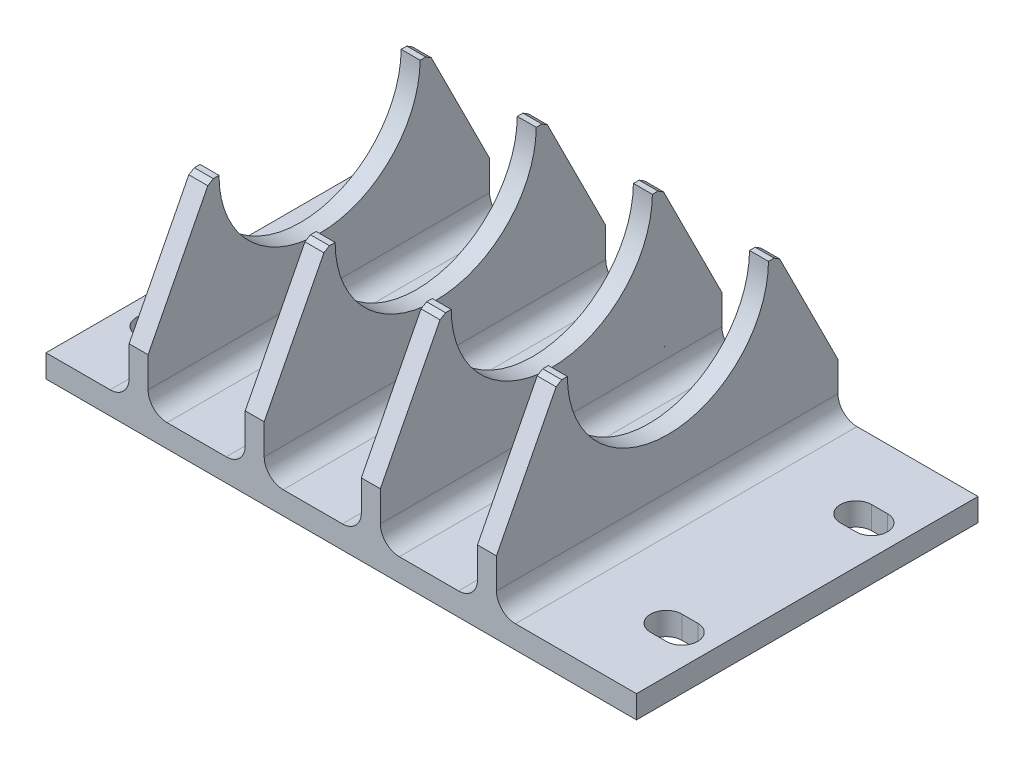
SolidWorks part; units mm, degrees
ref_plane "Front Plane" through (0, 0, 0) normal (0, 0, 1) x (1, 0, 0)
ref_plane "Top Plane" through (0, 0, 0) normal (0, 1, 0) x (1, 0, 0)
ref_plane "Right Plane" through (0, 0, 0) normal (1, 0, 0) x (0, 0, -1)
sketch "Sketch1" plane through (0, 0, 0) normal (0, 1, 0) x (1, 0, 0)
  line L0 (-77.8, 45) -> (77.8, 45)
  line L1 (-77.8, 45) -> (-77.8, -45)
  line L2 (-77.8, -45) -> (77.8, -45)
  line L3 (77.8, 45) -> (77.8, -45)
  circle A0 centre (-69.8, 25) radius 4.15
  circle A1 centre (-69.8, -25) radius 4.15
  circle A2 centre (69.8, 25) radius 4.15
  circle A3 centre (69.8, -25) radius 4.15
  dimension "D1" = 8.3
extrude "Boss-Extrude1" add sketch "Sketch1" along normal blind 6
sketch "Sketch4" plane through (0, 0, 45) normal (0, 0, 1) x (1, 0, 0)
  line L0 (-77.8, 6) -> (77.8, 6) construction
  line L1 (40.9, 6) -> (35.9, 6)
  line L2 (40.9, 6) -> (40.9, 56)
  line L3 (40.9, 56) -> (35.9, 56)
  line L4 (35.9, 6) -> (35.9, 56)
  line L6 (77.8, 6) -> (77.8, 0) construction
  dimension "D1" = 36.9
  dimension "D2" = 5
  dimension "D3" = 50
extrude "Boss-Extrude2" add sketch "Sketch4" against normal blind 90
pattern_linear "LPattern1" count 4 spacing 30.6 along (-1, 0, 0) of "Boss-Extrude2"
sketch "Sketch5" plane through (-55.9, 0, 0) normal (-1, 0, 0) x (0, 0, 1)
  line L1 (26.3067, 50.5874) -> (27.8067, 50.5874)
  line L2 (29.2629, 49.6975) -> (45, 19)
  line L3 (45, 56) -> (45, 6) construction
  line L5 (27.8067, 50.5874) -> (29.2629, 49.6975)
  line L8 (-28.1923, 50.3446) -> (-29.6407, 49.4421)
  line L10 (-29.6407, 49.4421) -> (-45.111, 18.6093)
  line L11 (-26.6923, 50.3576) -> (-28.1923, 50.3446)
  line L12 (45, 19) -> (60.8204, 19)
  line L13 (60.8204, 19) -> (60.8204, 68.7433)
  line L14 (60.8204, 68.7433) -> (-54.7485, 68.7433)
  line L15 (-54.7485, 68.7433) -> (-54.7485, 18.6093)
  line L16 (-54.7485, 18.6093) -> (-45.111, 18.6093)
  arc A0 (-26.6923, 50.3576) -> (26.3067, 50.5874) centre (-0.1933, 50.5874) ccw
  point P5 (28.8067, 50.5874)
  point P21 (-29.1922, 50.3359)
  dimension "D1" = 53
  dimension "D3" = 2.5
extrude "Cut-Extrude3" cut sketch "Sketch5" against normal blind 160
fillet "Fillet1" radius 5 8 edges at (10.3, 6, 0) (-20.3, 6, 0) (-50.9, 6, 0) (5.3, 6, 0) (-25.3, 6, 0) (-55.9, 6, 0)
sketch "Sketch6" plane through (0, 6, 0) normal (0, 1, 0) x (1, 0, 0)
  line L0 (-69.8, 25) -> (-65.65, 25) construction
  line L1 (-69.8, 29.15) -> (-65.65, 29.15)
  line L2 (-69.8, 20.85) -> (-65.65, 20.85)
  line L3 (-69.8, -25) -> (-65.65, -25) construction
  line L4 (-69.8, -20.85) -> (-65.65, -20.85)
  line L5 (-69.8, -29.15) -> (-65.65, -29.15)
  line L6 (69.8, 25) -> (65.65, 25) construction
  line L7 (69.8, 20.85) -> (65.65, 20.85)
  line L8 (69.8, 29.15) -> (65.65, 29.15)
  line L9 (69.8, -25) -> (65.65, -25) construction
  line L10 (69.8, -29.15) -> (65.65, -29.15)
  line L11 (69.8, -20.85) -> (65.65, -20.85)
  circle A0 centre (-69.8, 25) radius 4.15 construction
  arc A1 (-69.8, 29.15) -> (-69.8, 20.85) centre (-69.8, 25) ccw
  arc A2 (-65.65, 20.85) -> (-65.65, 29.15) centre (-65.65, 25) ccw
  circle A3 centre (-69.8, -25) radius 4.15 construction
  arc A4 (-69.8, -20.85) -> (-69.8, -29.15) centre (-69.8, -25) ccw
  arc A5 (-65.65, -29.15) -> (-65.65, -20.85) centre (-65.65, -25) ccw
  circle A6 centre (69.8, 25) radius 4.15 construction
  arc A7 (69.8, 20.85) -> (69.8, 29.15) centre (69.8, 25) ccw
  arc A8 (65.65, 29.15) -> (65.65, 20.85) centre (65.65, 25) ccw
  circle A9 centre (69.8, -25) radius 4.15 construction
  arc A10 (69.8, -29.15) -> (69.8, -20.85) centre (69.8, -25) ccw
  arc A11 (65.65, -20.85) -> (65.65, -29.15) centre (65.65, -25) ccw
  point P5 (-67.725, 25)
  point P15 (-67.725, -25)
  point P25 (67.725, 25)
  point P35 (67.725, -25)
  dimension "D1" = 8.3
  dimension "D2" = 8.3
  dimension "D3" = 8.3
  dimension "D4" = 8.3
extrude "Cut-Extrude4" cut sketch "Sketch6" against normal blind 10
sketch "Sketch7" plane through (0, 0, 0) normal (0, -1, 0) x (-1, 0, 0)
  line L0 (0, 0) -> (60, 0) construction
  line L1 (0, 0) -> (-45, 0) construction
  line L2 (0, -29.0247) -> (0, 28.2974) construction
  arc A0 (65.2521, -8.5098) -> (65.2521, 8.5098) centre (60, 0) ccw
  arc A1 (-65.2521, 8.5098) -> (-65.2521, -8.5098) centre (-60, 0) ccw
  arc A2 (65.2521, -8.5098) -> (-65.2521, -8.5098) centre (0, 97.2162) cw
  arc A3 (65.2521, 8.5098) -> (-65.2521, 8.5098) centre (0, -97.2162) ccw
  arc A4 (66.3025, -10.2117) -> (-66.3025, -10.2117) centre (0, 97.2162) cw
  arc A5 (-66.3025, 10.2117) -> (-66.3025, -10.2117) centre (-60, 0) ccw
  arc A6 (66.3025, 10.2117) -> (-66.3025, 10.2117) centre (0, -97.2162) ccw
  arc A7 (66.3025, -10.2117) -> (66.3025, 10.2117) centre (60, 0) ccw
  arc A8 (65.2521, -8.5098) -> (65.2521, 8.5098) centre (60, 0) ccw construction
  arc A9 (-65.2521, 8.5098) -> (-65.2521, -8.5098) centre (-60, 0) ccw construction
  arc A10 (65.2521, -8.5098) -> (-65.2521, -8.5098) centre (0, 97.2162) cw construction
  dimension "D3" = 20
  dimension "D1" = 2
  dimension "D2" = 60
  dimension "D4" = 120
extrude "Cut-Extrude5" cut sketch "Sketch7" against normal blind 1
sketch "Sketch9" plane through (0, 0, 0) normal (0, -1, 0) x (1, 0, 0)
  text T0 "FilaMaker" font "Magneto" height 15
extrude "Cut-Extrude6" cut sketch "Sketch9" against normal blind 1
